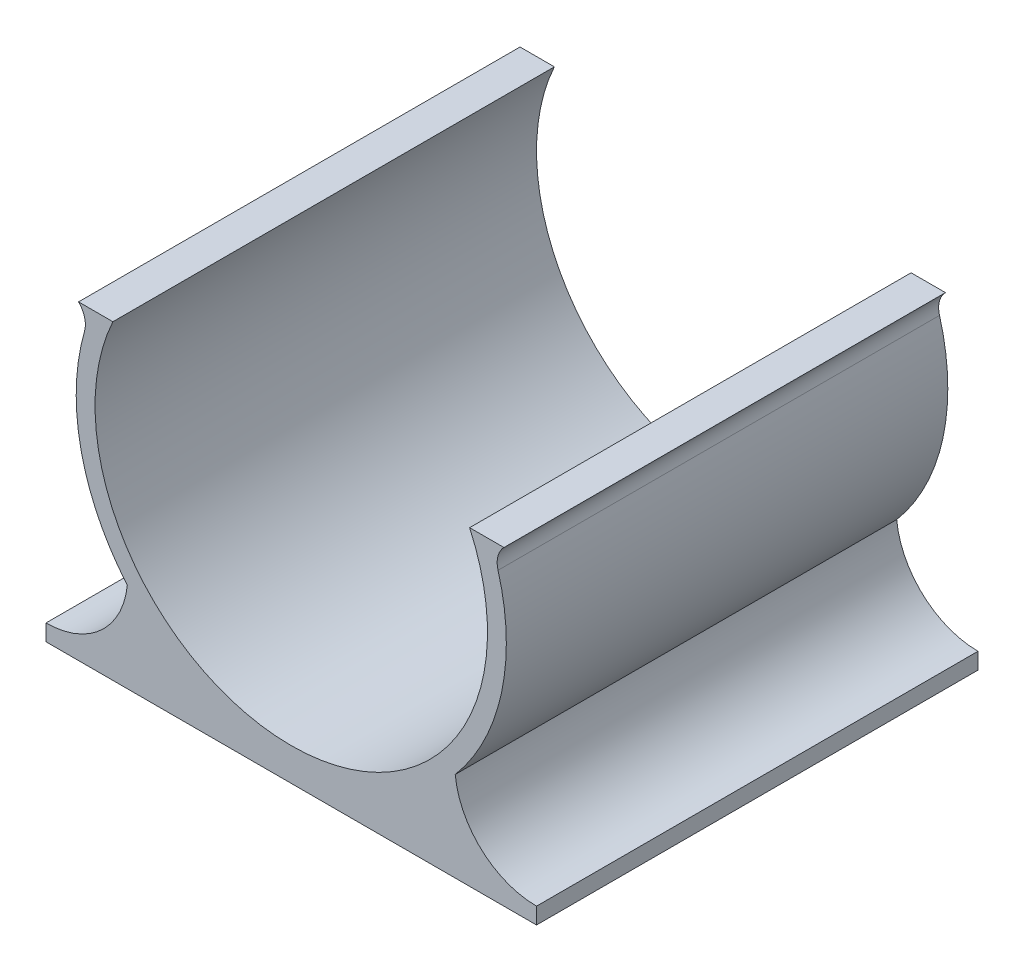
SolidWorks part; units mm, degrees
ref_plane "Front Plane" through (0, 0, 0) normal (0, 0, 1) x (1, 0, 0)
ref_plane "Top Plane" through (0, 0, 0) normal (0, 1, 0) x (1, 0, 0)
ref_plane "Right Plane" through (0, 0, 0) normal (1, 0, 0) x (0, 0, -1)
ref_plane "Plane1" through (0, -14, 0) normal (0, -1, 0) x (1, 0, 0)
sketch "Sketch1" plane through (0, -14, 0) normal (0, -1, 0) x (1, 0, 0)
  line L0 (-15, 0) -> (15, 0)
  line L1 (15, 0) -> (15, 27)
  line L2 (15, 27) -> (-15, 27)
  line L3 (-15, 27) -> (-15, 0)
extrude "Extrude1" add sketch "Sketch1" against normal blind 19
sketch "Sketch2" plane through (0, 0, 0) normal (0, 0, -1) x (-1, 0, 0)
  line L0 (-13.0098, 5) -> (-15, 5)
  line L1 (-15, 5) -> (-15, -13)
  arc A0 (-10.0264, -8.513) -> (-12.6469, 3.6134) centre (0, 0) cw
  arc A1 (-12.6469, 3.6134) -> (-13.0098, 5) centre (-14, 4) ccw
  arc A2 (-15, -13) -> (-10.0264, -8.513) centre (-15, -8) ccw
extrude "Cut-Extrude1" cut sketch "Sketch2" against normal up to next
sketch "Sketch3" plane through (0, 0, 0) normal (0, 0, -1) x (-1, 0, 0)
  line L0 (15, -13) -> (15, 5)
  line L1 (15, 5) -> (13.0098, 5)
  arc A0 (12.6469, 3.6134) -> (10.0264, -8.513) centre (0, 0) cw
  arc A1 (10.0264, -8.513) -> (15, -13) centre (15, -8) ccw
  arc A2 (13.0098, 5) -> (12.6469, 3.6134) centre (14, 4) ccw
extrude "Cut-Extrude2" cut sketch "Sketch3" against normal up to next
hole_wizard "Hole1" positions "Sketch5" profile "Sketch4" legacy
sketch "Sketch5" plane through (0, 0, 27) normal (0, 0, 1) x (1, 0, 0)
  point P0 (0, 0)
sketch "Sketch4" plane through (0, 0, 27) normal (1, 0, 0) x (0, -1, 0)
  line L0 (0, 0) -> (0, 27)
  line L1 (0, 27) -> (12, 27)
  line L2 (12, 27) -> (12, 0)
  line L3 (12, 0) -> (0, 0)
  line L4 (0, 110) -> (0, -10) construction
  dimension "Diameter" = 24
  dimension "Depth" = 27
